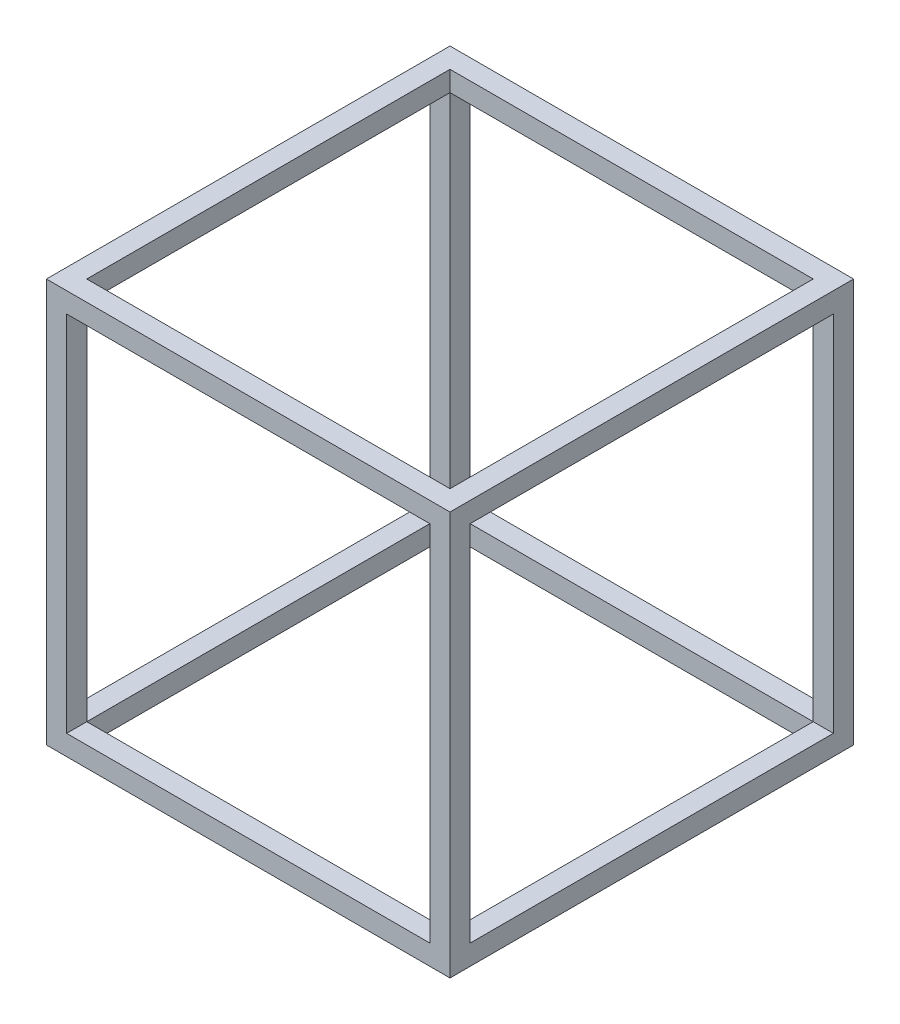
SolidWorks part; units mm, degrees
ref_plane "Front Plane" through (0, 0, 0) normal (0, 0, 1) x (1, 0, 0)
ref_plane "Top Plane" through (0, 0, 0) normal (0, 1, 0) x (1, 0, 0)
ref_plane "Right Plane" through (0, 0, 0) normal (1, 0, 0) x (0, 0, -1)
sketch "Sketch2" plane through (0, 0, 0) normal (0, 0, 1) x (1, 0, 0)
  line L1 (0, 0) -> (40, 0)
  line L2 (0, 0) -> (0, 40)
  line L3 (0, 40) -> (40, 40)
  line L4 (40, 0) -> (40, 40)
  dimension "D1" = 40
  dimension "D2" = 40
extrude "Extrude-Thin4" add sketch "Sketch2" against normal blind 40 thin
sketch "Sketch8" plane through (40, 0, 0) normal (1, 0, 0) x (0, 0, -1)
  line L0 (0, 40) -> (40, 0) construction
  line L1 (40, 40) -> (0, 0) construction
  line L3 (2, 2) -> (38, 2)
  line L4 (2, 2) -> (2, 38)
  line L5 (2, 38) -> (38, 38)
  line L6 (38, 2) -> (38, 38)
  line L7 (2, 2) -> (38, 38) construction
  line L8 (2, 38) -> (38, 2) construction
  point P8 (20, 20)
  dimension "D1" = 36
extrude "Cut-Extrude3" cut sketch "Sketch8" against normal blind 2
sketch "Sketch9" plane through (0, 0, 0) normal (-1, 0, 0) x (0, 0, 1)
  line L0 (-40, 40) -> (0, 0) construction
  line L1 (0, 40) -> (-40, 0) construction
  line L3 (-38, 2) -> (-2, 2)
  line L4 (-38, 2) -> (-38, 38)
  line L5 (-38, 38) -> (-2, 38)
  line L6 (-2, 2) -> (-2, 38)
  line L7 (-38, 2) -> (-2, 38) construction
  line L8 (-38, 38) -> (-2, 2) construction
  point P8 (-20, 20)
  dimension "D1" = 36
extrude "Cut-Extrude4" cut sketch "Sketch9" against normal blind 2
sketch "Sketch10" plane through (0, 40, 0) normal (0, 1, 0) x (1, 0, 0)
  line L0 (40, 0) -> (0, 40) construction
  line L1 (0, 0) -> (40, 40) construction
  line L3 (38, 38) -> (2, 38)
  line L4 (38, 38) -> (38, 2)
  line L5 (38, 2) -> (2, 2)
  line L6 (2, 38) -> (2, 2)
  line L7 (38, 38) -> (2, 2) construction
  line L8 (38, 2) -> (2, 38) construction
  point P8 (20, 20)
  dimension "D1" = 36
extrude "Cut-Extrude5" cut sketch "Sketch10" against normal blind 2
sketch "Sketch12" plane through (0, 0, 0) normal (0, -1, 0) x (1, 0, 0)
  line L0 (0, -40) -> (40, 0) construction
  line L1 (0, 0) -> (40, -40) construction
  line L3 (38, -38) -> (2, -38)
  line L4 (38, -38) -> (38, -2)
  line L5 (38, -2) -> (2, -2)
  line L6 (2, -38) -> (2, -2)
  line L7 (38, -38) -> (2, -2) construction
  line L8 (38, -2) -> (2, -38) construction
  point P8 (20, -20)
  dimension "D1" = 36
extrude "Cut-Extrude6" cut sketch "Sketch12" against normal blind 2
